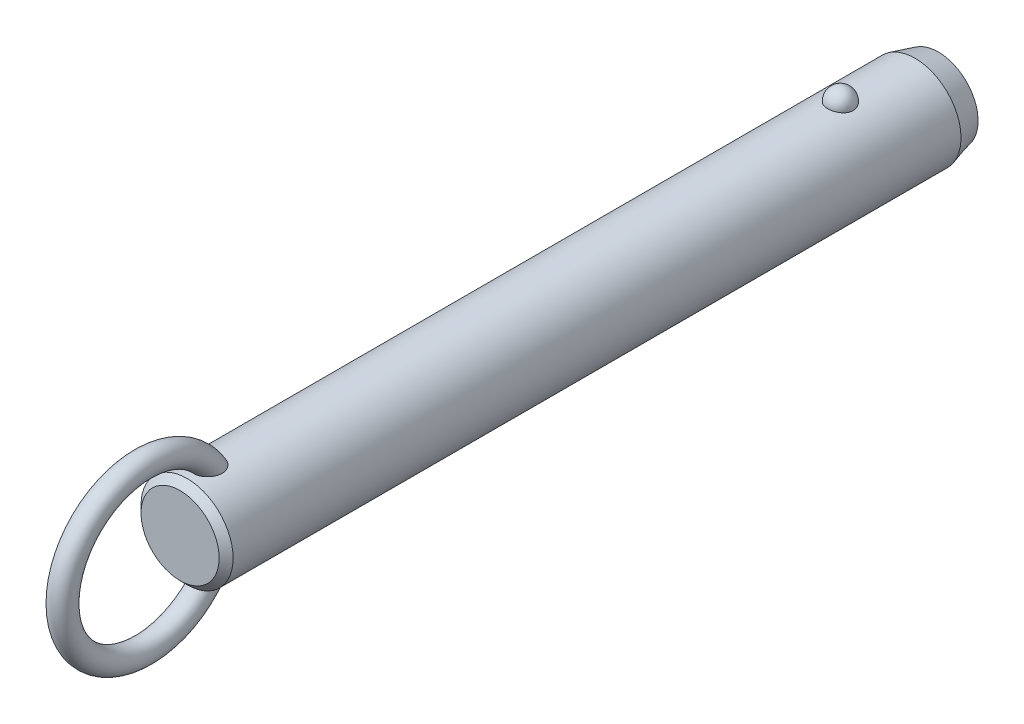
SolidWorks part; units mm, degrees
ref_plane "Front Plane" through (0, 0, 0) normal (0, 0, 1) x (1, 0, 0)
ref_plane "Top Plane" through (0, 0, 0) normal (0, 1, 0) x (1, 0, 0)
ref_plane "Right Plane" through (0, 0, 0) normal (1, 0, 0) x (0, 0, -1)
sketch "Sketch2" plane through (0, 0, 0) normal (0, 0, 1) x (1, 0, 0)
  circle A0 centre (0, 0) radius 7.9
  point P3 (0, 7.9)
  dimension "D1" = 15.8
extrude "Boss-Extrude1" add sketch "Sketch2" along normal blind 101.6
sketch "Sketch3" plane through (0, 0, 0) normal (0, 0, -1) x (-1, 0, 0)
  circle A0 centre (0, 0) radius 7.9
  dimension "D1" = 15.8
extrude "Boss-Extrude2" add sketch "Sketch3" along normal blind 19
chamfer "Chamfer1" distance 4 angle 15 1 edges at (-7.9, 0, -19)
sketch "Sketch12" plane through (0, 0, 0) normal (1, 0, 0) x (0, 0, -1)
  line L0 (-101.6, 7.9) -> (-101.6, -7.9) construction
  point P0 (-101.6, 0)
sketch "Sketch13" plane through (0, 0, 0) normal (1, 0, 0) x (0, 0, -1)
  circle A0 centre (-117.45, 0) radius 15.85
  point P2 (-101.6, 0)
  dimension "D1" = 31.7
sketch "Sketch14" plane through (0, 0, 0) normal (0, 1, 0) x (1, 0, 0)
  circle A0 centre (0, -103.6) radius 2
  point P2 (0, -101.6)
  dimension "D1" = 4
sweep "Sweep1" add profiles "Sketch14" path "Sketch13"
sketch "Sketch15" plane through (0, 0, 101.6) normal (0, 0, 1) x (1, 0, 0)
  circle A0 centre (0, 0) radius 7.9
  dimension "D1" = 15.8
extrude "Boss-Extrude3" add sketch "Sketch15" along normal blind 9.52
chamfer "Chamfer2" distance 1.2 angle 45 1 edges at (7.9, 0, 111.12)
sketch "Sketch18" plane through (0, 0, 0) normal (1, 0, 0) x (0, 0, -1)
  line L0 (15, 7.9) -> (-103.7091, 7.9) construction
  line L1 (2.2, 10.1) -> (2.2, 5.7)
  line L2 (-103.7091, -7.9) -> (15, -7.9) construction
  arc A0 (2.2, 10.1) -> (2.2, 5.7) centre (2.2, 7.9) ccw
  point P4 (0, 7.9)
  dimension "D1" = 18
revolve "Revolve1" add sketch "Sketch18" angle 360 about L1
